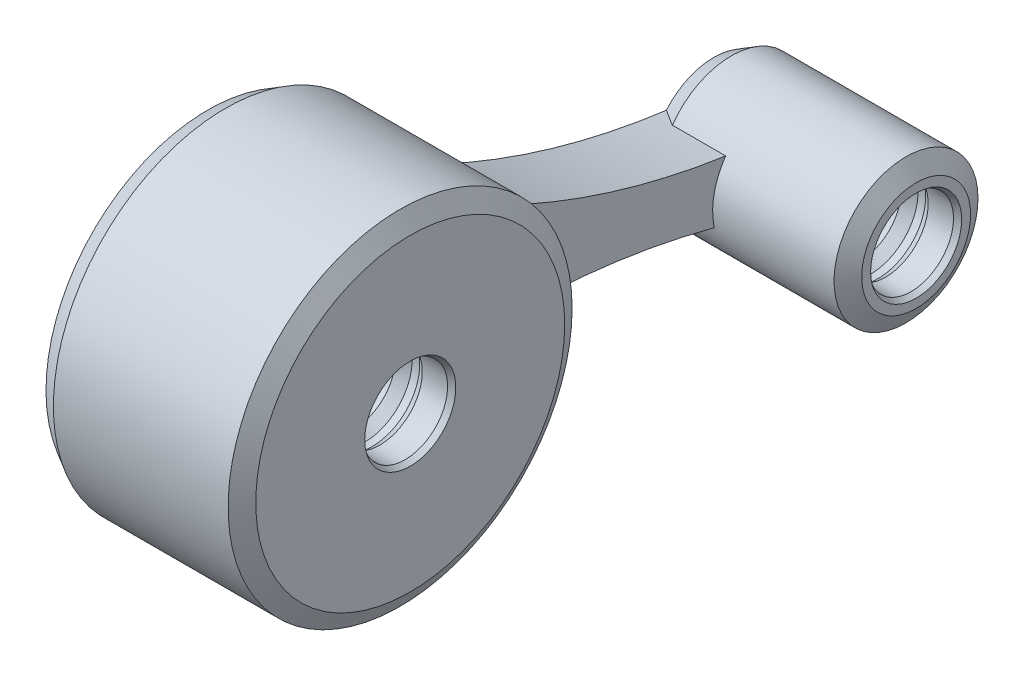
SolidWorks part; units mm, degrees
ref_plane "Front Plane" through (0, 0, 0) normal (0, 0, 1) x (1, 0, 0)
ref_plane "Top Plane" through (0, 0, 0) normal (0, 1, 0) x (1, 0, 0)
ref_plane "Right Plane" through (0, 0, 0) normal (1, 0, 0) x (0, 0, -1)
sketch "Sketch1" plane through (0, 0, 0) normal (1, 0, 0) x (0, 0, -1)
  circle A0 centre (0, 0) radius 7.1142
extrude "Boss-Extrude1" add sketch "Sketch1" along normal blind 20
sketch "Sketch2" plane through (0, 0, 0) normal (1, 0, 0) x (0, 0, -1)
  circle A0 centre (-50, 10.6191) radius 17
  circle A1 centre (0, 0) radius 7.1142 construction
  dimension "D1" = 34
  dimension "D2" = 50
extrude "Boss-Extrude2" add sketch "Sketch2" along normal blind 20 separate body
chamfer "Chamfer2" distance 1 angle 60 2 edges at (0, 10.6191, 33) (20, 10.6191, 33)
chamfer "Chamfer3" distance 1 angle 60 2 edges at (0, 0, -7.1142) (20, 0, -7.1142)
sketch "Sketch5" plane through (0, 0, 0) normal (1, 0, 0) x (0, 0, -1)
  line L0 (-50, 10.6191) -> (0, 0) construction
  arc A0 (-42.3017, 20.1074) -> (-47.0308, -1.2331) centre (-50, 10.6191) ccw
  arc A1 (-1.1314, -3.2624) -> (0.225, 3.4456) centre (0, 0) ccw
  arc A2 (-42.3017, 20.1074) -> (0.225, 3.4456) centre (5.1301, 78.568) ccw
  arc A3 (-1.1314, -3.2624) -> (-47.0308, -1.2331) centre (-27.4856, -79.2534) ccw
extrude "Boss-Extrude4" add sketch "Sketch5" along normal blind 7
ref_plane "Plane1" through (0, 0, 0) normal (0, 0.9782, -0.2077) x (-1, 0, 0)
sketch "Sketch9" plane through (0, 0, 0) normal (0, 0.9782, -0.2077) x (-1, 0, 0)
  line L0 (0, 46.6152) -> (0, 51.1152)
  line L1 (0, 46.6152) -> (-0.5, 46.9236)
  line L2 (-0.5, 46.9236) -> (-3, 46.9236)
  line L3 (-3, 46.9236) -> (-3.75, 46.4236)
  line L4 (-3.75, 46.4236) -> (-4.5, 46.4236)
  line L5 (-4.5, 46.4236) -> (-5.4656, 47.1236)
  line L6 (-5.4656, 47.1236) -> (-6, 47.1236)
  line L7 (0, 51.1152) -> (-6, 51.1152)
  line L8 (-6, 51.1152) -> (-6, 47.1236)
  line L12 (-19, 51.1152) -> (-7, 51.1152) construction
  line L13 (0, 36.7634) -> (0, 67.1152) construction
  dimension "D1" = 0.5344
  dimension "D2" = 0.75
  dimension "D3" = 2.5
  dimension "D4" = 0.9656
  dimension "D5" = 0.75
  dimension "D6" = 0.5
  dimension "D7" = 0.7
  dimension "D8" = 0.5
  dimension "D9" = 0.3084
  dimension "D10" = 4.5
ref_plane "mirror plane" through (10, 0, 0) normal (1, 0, 0) x (0, 0, -1)
revolve "Cut-Revolve1" cut sketch "Sketch9" angle 360 about L7
sketch "Sketch13" plane through (0, 0, 0) normal (0, 0.9782, -0.2077) x (-1, 0, 0)
  line L0 (0, -4.5) -> (0, 0)
  line L1 (0, -4.5) -> (-0.5, -4.1916)
  line L2 (-0.5, -4.1916) -> (-3, -4.1916)
  line L3 (-3, -4.1916) -> (-3.75, -4.6916)
  line L4 (-3.75, -4.6916) -> (-4.5, -4.6916)
  line L5 (-4.5, -4.6916) -> (-5.4656, -3.9916)
  line L6 (-5.4656, -3.9916) -> (-6, -3.9916)
  line L7 (0, 0) -> (-6, 0)
  line L8 (-6, 0) -> (-6, -3.9916)
  line L9 (-19, 0) -> (-7, 0) construction
  line L10 (0, -6.1142) -> (0, 5.3992) construction
  dimension "D1" = 0.5344
  dimension "D2" = 0.75
  dimension "D3" = 2.5
  dimension "D4" = 0.9656
  dimension "D5" = 0.75
  dimension "D6" = 0.5
  dimension "D7" = 0.7
  dimension "D8" = 0.5
  dimension "D9" = 0.3084
  dimension "D10" = 4.5
revolve "Cut-Revolve2" cut sketch "Sketch13" angle 360 about L7
mirror "Mirror1" about plane through (10, 0, 0) normal (1, 0, 0) of "Cut-Revolve2", "Cut-Revolve1"
